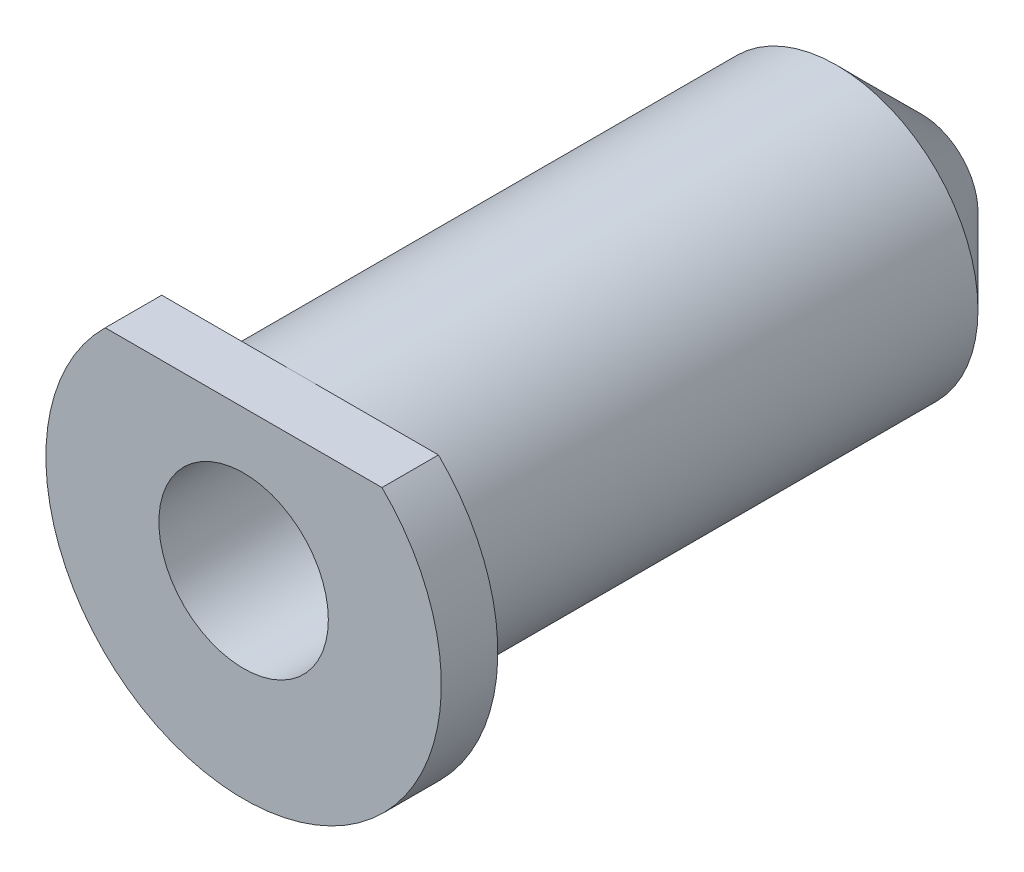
SolidWorks part; units mm, degrees
ref_plane "Plan de face" through (0, 0, 0) normal (0, 0, 1) x (1, 0, 0)
ref_plane "Plan de dessus" through (0, 0, 0) normal (0, 1, 0) x (1, 0, 0)
ref_plane "Plan de droite" through (0, 0, 0) normal (1, 0, 0) x (0, 0, -1)
sketch "Esquisse1" plane through (0, 0, 0) normal (0, 0, 1) x (1, 0, 0)
  circle A0 centre (0, 0) radius 5
  dimension "D1" = 10
extrude "Boss.-Extru.1" add sketch "Esquisse1" along normal blind 22
sketch "Esquisse2" plane through (0, 0, 22) normal (0, 0, 1) x (1, 0, 0)
  circle A0 centre (0, 0) radius 7
  dimension "D1" = 14
extrude "Boss.-Extru.2" add sketch "Esquisse2" along normal blind 2
chamfer "Chanfrein1" distance 3 angle 45 1 edges at (5, 0, 0)
shell "Coque1" thickness 2
sketch "Esquisse3" plane through (0, 0, 24) normal (0, 0, 1) x (1, 0, 0)
  circle A0 centre (0, 0) radius 1.5
  dimension "D1" = 3
extrude "Enlèv. mat.-Extru.1" cut sketch "Esquisse3" against normal through all
sketch "Esquisse4" plane through (0, 0, 22) normal (0, 0, -1) x (-1, 0, 0)
  line L1 (-6, 9) -> (6, 9)
  line L2 (-6, 9) -> (-6, 5)
  line L3 (-6, 5) -> (6, 5)
  line L4 (6, 9) -> (6, 5)
  line L5 (-6, 9) -> (6, 5) construction
  line L6 (-6, 5) -> (6, 9) construction
  circle A0 centre (0, 0) radius 7 construction
  point P0 (0, 7)
  dimension "D1" = 4
  dimension "D2" = 12
extrude "Enlèv. mat.-Extru.2" cut sketch "Esquisse4" against normal blind 10
